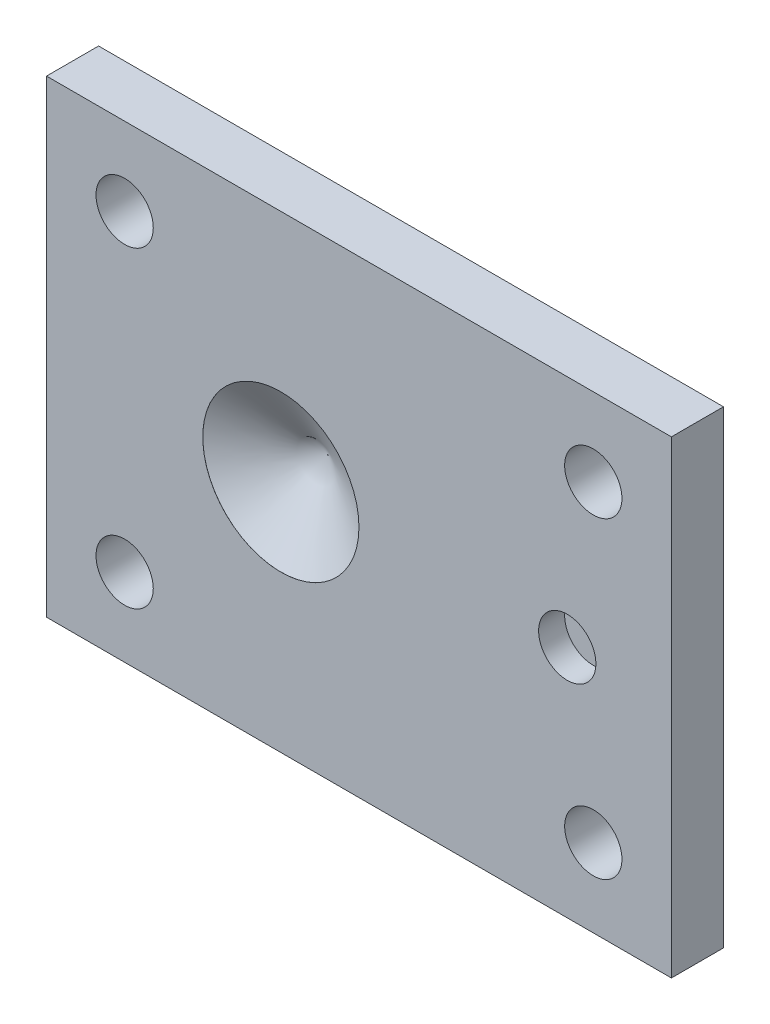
SolidWorks part; units mm, degrees
ref_plane "Plan de face" through (0, 0, 0) normal (0, 0, 1) x (1, 0, 0)
ref_plane "Plan de dessus" through (0, 0, 0) normal (0, 1, 0) x (1, 0, 0)
ref_plane "Plan de droite" through (0, 0, 0) normal (1, 0, 0) x (0, 0, -1)
sketch "Esquisse1" plane through (0, 0, 0) normal (0, 0, 1) x (1, 0, 0)
  line L0 (0, 0) -> (120, 0)
  line L1 (120, 0) -> (120, 90)
  line L2 (120, 90) -> (0, 90)
  line L3 (0, 90) -> (0, 0)
  dimension "D1" = 90
  dimension "D2" = 120
extrude "Extrusion1" add sketch "Esquisse1" along normal blind 10
sketch "Esquisse2" plane through (0, 0, 10) normal (0, 0, 1) x (1, 0, 0)
  line L0 (0, 90) -> (0, 0) construction
  line L1 (120, 90) -> (0, 90) construction
  line L2 (0, 0) -> (120, 0) construction
  line L3 (120, 0) -> (120, 90) construction
  circle A0 centre (15, 75) radius 5.5
  circle A1 centre (105, 75) radius 5.5
  circle A2 centre (105, 15) radius 5.5
  circle A3 centre (15, 15) radius 5.5
  dimension "D13" = 11
  dimension "D14" = 11
  dimension "D15" = 11
  dimension "D16" = 11
  dimension "D1" = 15
  dimension "D2" = 15
  dimension "D3" = 15
  dimension "D4" = 15
  dimension "D5" = 15
  dimension "D6" = 15
  dimension "D7" = 15
  dimension "D8" = 15
extrude "Enlèv. mat.-Extru.1" cut sketch "Esquisse2" against normal through all
sketch "Esquisse4" plane through (0, 0, 10) normal (0, 0, 1) x (1, 0, 0)
  line L0 (0, 90) -> (0, 0) construction
  line L1 (120, 90) -> (0, 90) construction
  circle A0 centre (45, 45) radius 16.3722
  dimension "D1" = 45
  dimension "D3" = 32.7445
  dimension "D2" = 45
hole_wizard "Dégagement M61" positions "Esquisse3D1" profile "Esquisse5" hole size "M6" standard "ISO"
sketch3d "Esquisse3D1"
  point P0 (45, 45, 10)
sketch "Esquisse5" plane through (45, 45, 10) normal (1, 0, 0) x (0, -1, 0)
  line L0 (0, 0) -> (0, 9.0229)
  line L1 (0, 9.0229) -> (15, 0.01)
  line L2 (15, 0.01) -> (15, 0)
  line L5 (15, 0) -> (0, 0)
  line L10 (0, 9.0229) -> (-15, 0.01) construction
  line L11 (0, -6.35) -> (0, 107.95) construction
  dimension "Diamètre du perçage" = 30
  dimension "Profondeur du perçage" = 0.01
  dimension "Angle de pointe" = 118
sketch "Esquisse6" plane through (0, 0, 10) normal (0, 0, 1) x (1, 0, 0)
  line L0 (0, 90) -> (0, 0) construction
  line L1 (120, 90) -> (0, 90) construction
  circle A0 centre (100, 45) radius 5.5
  point P2 (0, 45)
  dimension "D3" = 11
  dimension "D1" = 100
  dimension "D2" = 45
extrude "Enlèv. mat.-Extru.2" cut sketch "Esquisse6" against normal blind 5
